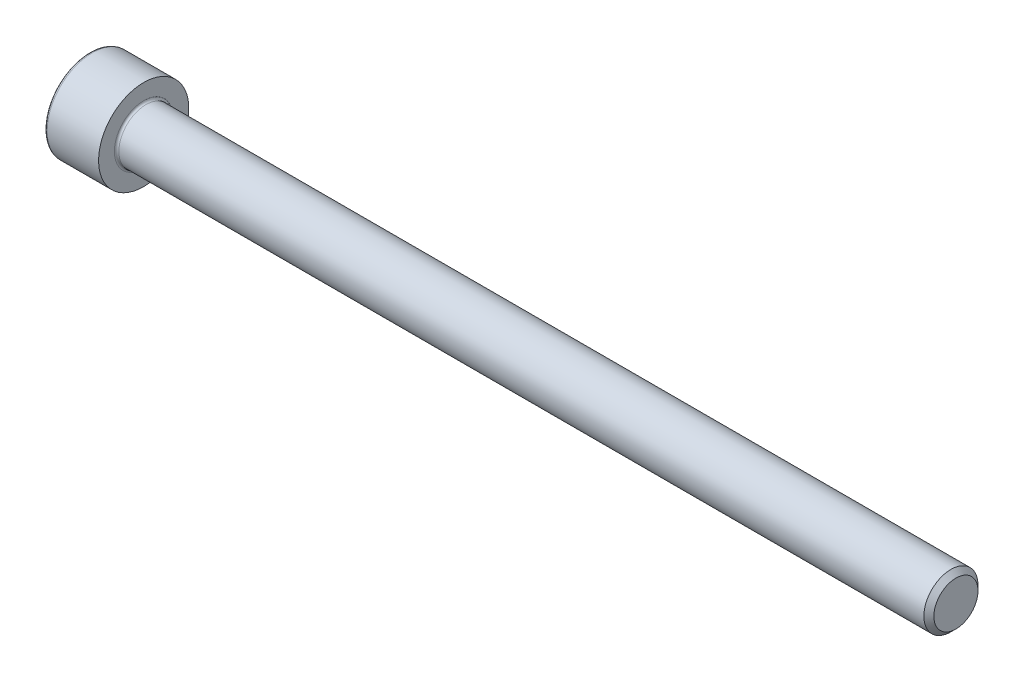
SolidWorks part; units mm, degrees
ref_plane "Plane1" through (0, 0, 0) normal (0, 0, 1) x (1, 0, 0)
ref_plane "Plane2" through (0, 0, 0) normal (0, 1, 0) x (1, 0, 0)
ref_plane "Plane3" through (0, 0, 0) normal (1, 0, 0) x (0, 0, -1)
sketch "BodySke" plane through (0, 0, 0) normal (0, 0, 1) x (1, 0, 0)
  line L0 (0, 0) -> (0, 5)
  line L1 (0, 5) -> (6, 5)
  line L2 (6, 5) -> (6, 3)
  line L3 (6, 3) -> (95.4455, 3)
  line L4 (96, 2.4455) -> (96, 0)
  line L5 (96, 0) -> (0, 0)
  line L6 (-31.75, 0) -> (127, 0) construction
  line L8 (96, 2.4455) -> (95.4455, 3)
  line L10 (96, -2.4455) -> (95.4455, -3) construction
  line L11 (7, 9.525) -> (7, 3.175) construction
  line L12 (72, 9.525) -> (72, 3.175) construction
  line L13 (6, 9.525) -> (6, 3.175) construction
  dimension "Diameter" = 6
  dimension "Head_ht" = 6
  dimension "Length" = 90
  dimension "Body_ch_ang" = 45
  dimension "Head_dia" = 10
  dimension "Minor_dia" = 4.891
  dimension "Advance" = 1
  dimension "Thread_nom" = 24
  dimension "Thread_length" = 90
revolve "Base-Revolve" add sketch "BodySke"
fillet "Fillet1" radius 0.25 1 edges at (6, 0, 3)
fillet "Fillet2" radius 0.3 1 edges at (0, 0, 5)
sketch "Sketch2" plane through (0, 0, 0) normal (0, 0, 1) x (1, 0, 0)
  line L0 (0, 2.542) -> (3, 2.542)
  line L1 (3, 2.542) -> (4.4676, 0)
  line L2 (-31.75, 0) -> (127, 0) construction
  line L3 (4.4676, 0) -> (0, 0)
  line L4 (0, 0) -> (0, 2.542)
  line L6 (0, 0) -> (47.625, 0) construction
  dimension "D1" = 2.542
  dimension "D2" = 60
  dimension "Depth" = 3
revolve "Hex-PreBroach" cut sketch "Sketch2" angle 360 about L6
sketch "Sketch3" plane through (0, 0, 0) normal (-1, 0, 0) x (0, 0.5, 0.866)
  line L0 (1.4676, 2.542) -> (-1.4676, 2.542)
  line L1 (-1.4676, 2.542) -> (-2.9352, 0)
  line L2 (1.4676, 2.542) -> (2.9352, 0)
  line L3 (1.4676, -2.542) -> (2.9352, 0)
  line L4 (1.4676, -2.542) -> (-1.4676, -2.542)
  line L5 (-1.4676, -2.542) -> (-2.9352, 0)
  dimension "D1" = 2.542
  dimension "D2" = 2.542
  dimension "Hex_size" = 5.084
extrude "Hex" cut sketch "Sketch3" against normal blind 3
sketch "ThdSchSke" plane through (0, 0, 0) normal (0, 0, 1) x (1, 0, 0)
  line L0 (72, -2.4455) -> (71.6117, -3)
  line L1 (72, -2.4455) -> (72.3883, -3)
  line L2 (72.3883, -3) -> (72.3883, -3.75)
  line L3 (-3.175, 0) -> (5.1513, 0) construction
  line L4 (0, 4.7) -> (0, -4.7) construction
  line L5 (72.3883, -3.75) -> (71.6117, -3.75)
  line L6 (71.6117, -3.75) -> (71.6117, -3)
  dimension "Thread_minor" = 4.891
  dimension "Diameter" = 6
  dimension "Start" = 72
  dimension "SideAngle" = 55
  dimension "VeeAngle" = 70
  dimension "Overcut" = 7.5
revolve "ThreadSchematic" [suppressed] cut sketch "ThdSchSke" angle 360 about L3
pattern_linear "ThdSchPat" [suppressed]
equation "\"D2@Sketch3\" = \"Hex_size@Sketch3\" / 2"
equation "\"D1@Sketch3\" = \"Hex_size@Sketch3\" / 2"
equation "\"D1@Sketch2\" = \"Hex_size@Sketch3\" / 2"
equation "\"Thread_minor@ThreadCosmetic\"  =  \"Minor_dia@BodySke\""
equation "\"Depth@Sketch2\" =  \"Key_eng@Hex\""
equation "\"Thread_length@ThreadCosmetic\" = ((sgn( (\"Length@BodySke\" - \"Advance@BodySke\" * 3.0) - \"Thread_nom@BodySke\" )-1)*( (\"Length@BodySke\" - \"Advance@BodySke\" * 3.0) - \"Thread_nom@BodySke\" ))/-2+ \"Thread_no"
equation "\"Thread_minor@ThdSchSke\" = \"Minor_dia@BodySke\""
equation "\"Diameter@ThdSchSke\" = \"Diameter@BodySke\""
equation "\"Overcut@ThdSchSke\" = \"Diameter@BodySke\" * 1.25"
equation "\"Start@ThdSchSke\" = \"Head_ht@BodySke\" + \"Length@BodySke\" - \"Thread_length@ThreadCosmetic\"  '---Non-countersunk---"
equation "\"Num_threads@ThdSchPat\" = int( \"Thread_length@ThreadCosmetic\" / \"Advance@BodySke\" + 0.999 )  + 1"
equation "\"Advance@ThdSchPat\" = \"Thread_length@ThreadCosmetic\" /  (\"Num_threads@ThdSchPat\" - 1) 'relax it"
equation "\"Num_threads@ThdSchPat\" = \"Num_threads@ThdSchPat\" - sgn( \"Num_threads@ThdSchPat\" - 1) '---chamfered tips only---"
